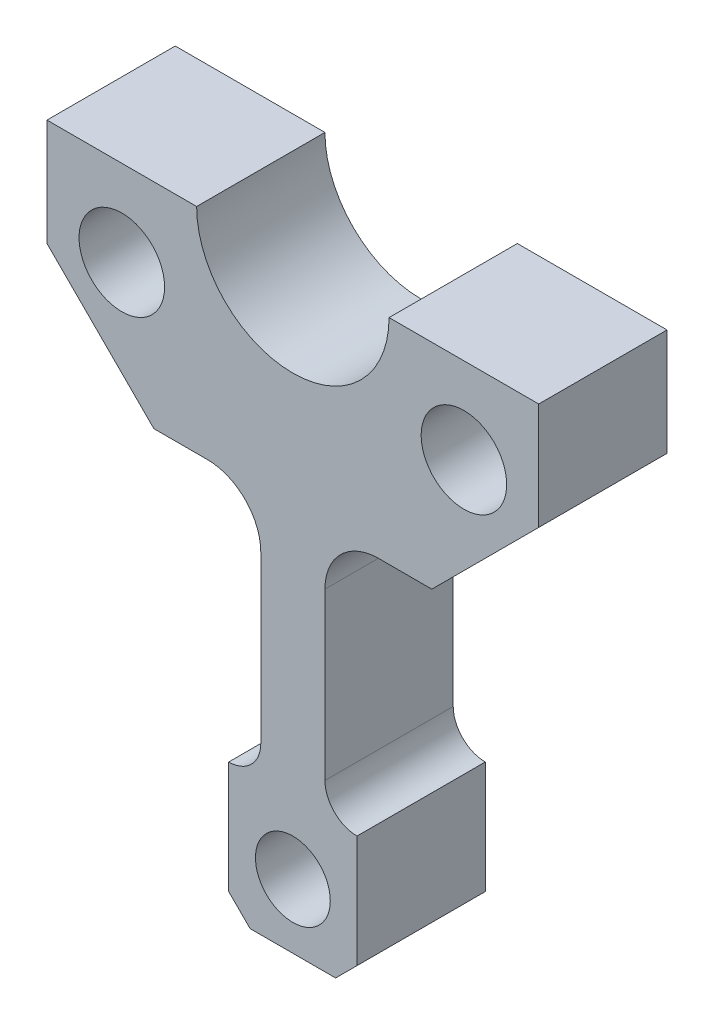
SolidWorks part; units mm, degrees
ref_plane "Plan de face" through (0, 0, 0) normal (0, 0, 1) x (1, 0, 0)
ref_plane "Plan de dessus" through (0, 0, 0) normal (0, 1, 0) x (1, 0, 0)
ref_plane "Plan de droite" through (0, 0, 0) normal (1, 0, 0) x (0, 0, -1)
sketch "Esquisse1" plane through (0, 0, 0) normal (0, 0, 1) x (1, 0, 0)
  line L0 (0, 0) -> (0, -87.8813) construction
  line L1 (-23, 0) -> (23, 0)
  line L2 (23, 0) -> (23, -20)
  line L3 (23, -20) -> (3, -20)
  line L4 (3, -20) -> (3, -43.5)
  line L5 (3, -43.5) -> (6, -43.5)
  line L6 (6, -43.5) -> (6, -56)
  line L7 (6, -56) -> (-6, -56)
  line L8 (-6, -43.5) -> (-6, -56)
  line L9 (-3, -43.5) -> (-6, -43.5)
  line L10 (-3, -20) -> (-3, -43.5)
  line L11 (-23, -20) -> (-3, -20)
  line L12 (-23, 0) -> (-23, -20)
  point P11 (0, -56)
  dimension "D1" = 46
  dimension "D2" = 20
  dimension "D3" = 56
  dimension "D4" = 12.5
  dimension "D5" = 6
  dimension "D6" = 12
extrude "Extrusion1" add sketch "Esquisse1" along normal blind 12
chamfer "Chanfrein1" distance 10 angle 45 1 edges at (-23, -20, 6)
chamfer "Chanfrein2" distance 10 angle 45 1 edges at (23, -20, 6)
sketch "Esquisse2" plane through (0, 0, 12) normal (0, 0, 1) x (1, 0, 0)
  circle A0 centre (0, 0) radius 9
  dimension "D1" = 18
extrude "Enlèv. mat.-Extru.1" cut sketch "Esquisse2" against normal blind 12
fillet "Congé1" radius 5 1 edges at (-3, -20, 6)
fillet "Congé2" radius 3 1 edges at (-3, -43.5, 6)
fillet "Congé3" radius 5 1 edges at (3, -20, 6)
fillet "Congé4" radius 3 1 edges at (3, -43.5, 6)
chamfer "Chanfrein3" distance 2 angle 45 2 edges at (6, -56, 6) (-6, -56, 6)
sketch "Esquisse3" plane through (0, 0, 12) normal (0, 0, 1) x (1, 0, 0)
  line L0 (0, 0) -> (0, -57.5252) construction
  line L1 (0, 0) -> (-0.1866, -0.0606) construction
  line L2 (0, 0) -> (-38.5319, -19.329) construction
  circle A0 centre (-15.9998, -8.0261) radius 4
  dimension "D3" = 8
  dimension "D1" = 63.36
  dimension "D2" = 17.9
extrude "Enlèv. mat.-Extru.2" cut sketch "Esquisse3" against normal through all
mirror "Symétrie1" about plane through (0, 0, 0) normal (1, 0, 0) of "Enlèv. mat.-Extru.2"
sketch "Esquisse4" plane through (0, 0, 12) normal (0, 0, 1) x (1, 0, 0)
  circle A0 centre (0, -50) radius 3.5
  dimension "D1" = 7
  dimension "D2" = 50
extrude "Enlèv. mat.-Extru.3" cut sketch "Esquisse4" against normal through all
